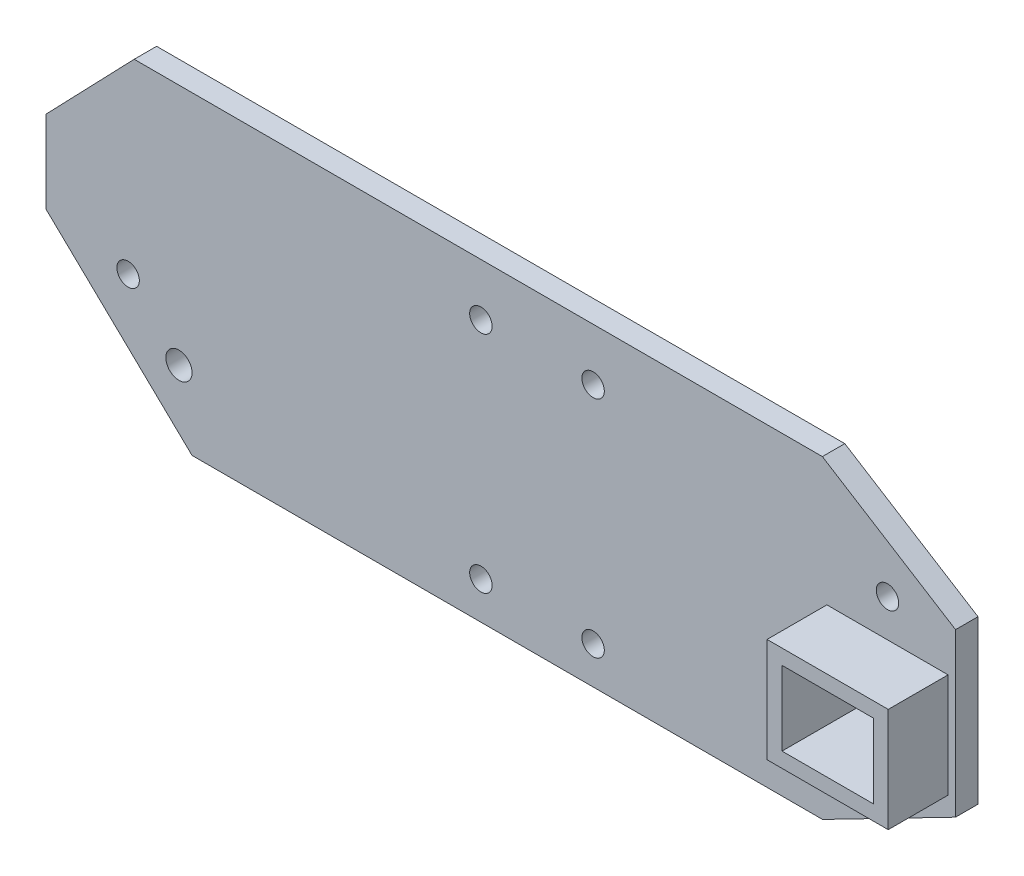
SolidWorks part; units mm, degrees
ref_plane "Front Plane" through (0, 0, 0) normal (0, 0, 1) x (1, 0, 0)
ref_plane "Top Plane" through (0, 0, 0) normal (0, 1, 0) x (1, 0, 0)
ref_plane "Right Plane" through (0, 0, 0) normal (1, 0, 0) x (0, 0, -1)
sketch "Sketch1" plane through (0, 0, 0) normal (0, 0, 1) x (1, 0, 0)
  line L0 (-125.1866, 38.8744) -> (-33.1866, 38.8744)
  line L1 (-117.4534, -3.1256) -> (-33.1634, -3.1256)
  line L2 (-33.1866, 38.8744) -> (-15.3812, 27.7402)
  line L3 (-15.3812, 27.7402) -> (-15.3812, 6.0283)
  line L4 (-15.3812, 6.0283) -> (-33.1634, -3.1256)
  line L5 (-117.4534, -3.1256) -> (-136.9752, 15.6258)
  line L6 (-136.9752, 15.6258) -> (-136.9752, 26.6258)
  line L7 (-136.9752, 26.6258) -> (-125.1866, 38.8744)
  dimension "D1" = 92
  dimension "D2" = 84.29
  dimension "D3" = 42
  dimension "D4" = 20
  dimension "D5" = 21
  dimension "D6" = 21.7119
  dimension "D7" = 27.0688
  dimension "D8" = 11
  dimension "D9" = 17
extrude "Boss-Extrude1" add sketch "Sketch1" along normal blind 3
sketch "Sketch2" plane through (0, 0, 3) normal (0, 0, 1) x (1, 0, 0)
  line L0 (-24.4812, 20.0093) -> (-24.4812, 27.0093) construction
  line L1 (-15.3812, 6.0283) -> (-15.3812, 27.7402) construction
  line L2 (-18.3812, 10.0793) -> (-18.3812, 20.0093)
  line L3 (-18.3812, 20.0093) -> (-30.5812, 20.0093)
  line L4 (-30.5812, 20.0093) -> (-30.5812, 10.0793)
  line L5 (-30.5812, 10.0793) -> (-18.3812, 10.0793)
  line L8 (-24.4812, 20.0093) -> (-24.4812, 20.1093) construction
  line L12 (-15.3812, 16.8843) -> (-15.3812, 15.0443) construction
  line L13 (-15.3812, 15.0443) -> (-18.3812, 15.0443) construction
  circle A1 centre (-24.4812, 27.0093) radius 1.5
  point P7 (-18.3812, 15.0443)
  dimension "D9" = 3
  dimension "D2" = 9.93
  dimension "D3" = 12.2
  dimension "D6" = 0.1
  dimension "D7" = 7
  dimension "D10" = 1.84
  dimension "D11" = 3
extrude "Cut-Extrude2" cut sketch "Sketch2" against normal blind 5
sketch "Sketch4" plane through (0, 0, 0) normal (0, 0, -1) x (-1, 0, 0)
  line L0 (79.1866, 38.8744) -> (79.1866, 33.8744) construction
  line L1 (33.1866, 38.8744) -> (125.1866, 38.8744) construction
  line L2 (63.8366, 31.8744) -> (63.8366, 38.8744) construction
  line L3 (63.8366, 31.8744) -> (63.8366, 1.8744) construction
  line L4 (78.8366, 31.8744) -> (78.8366, 1.8744) construction
  line L5 (78.8366, 31.8744) -> (78.8366, 38.8744) construction
  circle A0 centre (63.8366, 31.8744) radius 1.5
  circle A1 centre (78.8366, 31.8744) radius 1.5
  circle A2 centre (63.8366, 1.8744) radius 1.5
  circle A3 centre (78.8366, 1.8744) radius 1.5
  point P7 (79.1866, 33.8744)
  dimension "D3" = 3
  dimension "D4" = 3
  dimension "D7" = 3
  dimension "D8" = 3
  dimension "D1" = 5
  dimension "D2" = 15
  dimension "D5" = 30
  dimension "D6" = 30
  dimension "D9" = 7
  dimension "D10" = 7
extrude "Cut-Extrude4" cut sketch "Sketch4" against normal blind 3
sketch "Sketch6" plane through (0, 0, 0) normal (0, 0, -1) x (-1, 0, 0)
  line L0 (117.4534, -3.1256) -> (117.4534, 6.4444) construction
  line L1 (117.4534, 6.4444) -> (119.1991, 6.4444) construction
  line L2 (136.9752, 15.6258) -> (125.9989, 15.6258) construction
  line L3 (125.9989, 15.6258) -> (125.9989, 13.5903) construction
  circle A0 centre (119.1991, 6.4444) radius 1.7526
  circle A1 centre (125.9989, 13.5903) radius 1.5
  dimension "D3" = 3.5052
  dimension "D6" = 3
  dimension "D1" = 9.57
  dimension "D2" = 1.7457
  dimension "D4" = 10.9763
  dimension "D5" = 2.0355
extrude "Cut-Extrude5" cut sketch "Sketch6" against normal blind 5
sketch "Sketch7" plane through (0, 0, 3) normal (0, 0, 1) x (1, 0, 0)
  line L0 (-30.5812, 20.0093) -> (-18.3812, 20.0093)
  line L1 (-18.3812, 20.0093) -> (-18.3812, 10.0793)
  line L2 (-18.3812, 10.0793) -> (-30.5812, 10.0793)
  line L3 (-30.5812, 10.0793) -> (-30.5812, 20.0093)
  line L4 (-32.5812, 8.0793) -> (-32.5812, 22.0093)
  line L5 (-32.5812, 22.0093) -> (-16.3812, 22.0093)
  line L6 (-16.3812, 22.0093) -> (-16.3812, 8.0793)
  line L7 (-16.3812, 8.0793) -> (-32.5812, 8.0793)
  dimension "D1" = 2
extrude "Boss-Extrude2" add sketch "Sketch7" along normal blind 8
